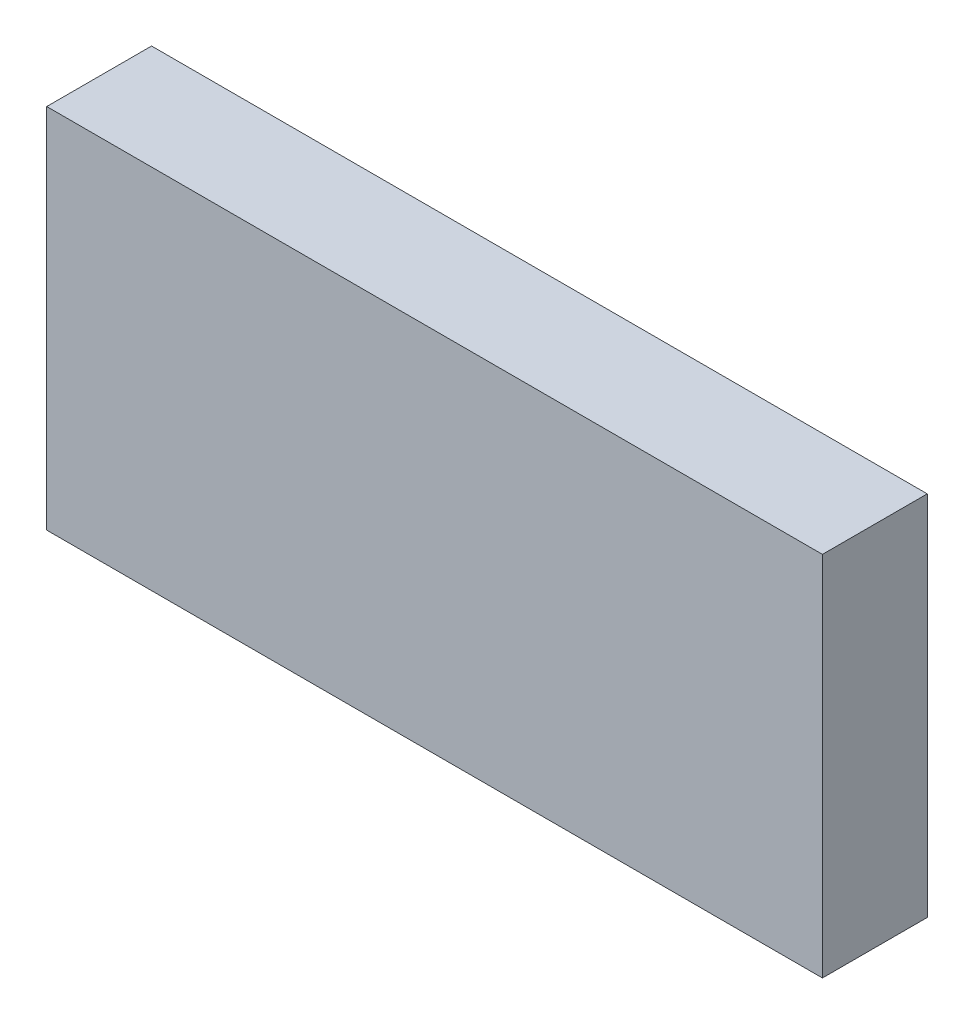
SolidWorks part; units mm, degrees
ref_plane "Front Plane" through (0, 0, 0) normal (0, 0, 1) x (1, 0, 0)
ref_plane "Top Plane" through (0, 0, 0) normal (0, 1, 0) x (1, 0, 0)
ref_plane "Right Plane" through (0, 0, 0) normal (1, 0, 0) x (0, 0, -1)
sketch "Sketch1" plane through (703.5835, 0, 0) normal (1, 0, 0) x (0, 0, -1)
  line L0 (-1417.1893, 961.7827) -> (-1417.1893, 911.7827) construction
  line L1 (-1419.1893, 961.7827) -> (-1417.1893, 961.7827)
  line L2 (-1419.1893, 961.7827) -> (-1419.1893, 954.7827)
  line L3 (-1419.1893, 954.7827) -> (-1417.1893, 954.7827)
  line L4 (-1417.1893, 961.7827) -> (-1417.1893, 954.7827)
  line L5 (-1417.1893, 961.7827) -> (-1419.1893, 961.7827) construction
  line L6 (-1419.1893, 961.7827) -> (-1419.1893, 911.7827) construction
  point P4 (0, 0)
  point P7 (0, 0)
  point P9 (-1419.3383, 955.2162)
  point P10 (-1417.1893, 961.7827)
  point P15 (-1419.1893, 961.7827)
  dimension "D1" = 7
extrude "Boss-Extrude1" add sketch "Sketch1" along normal blind 14.8
